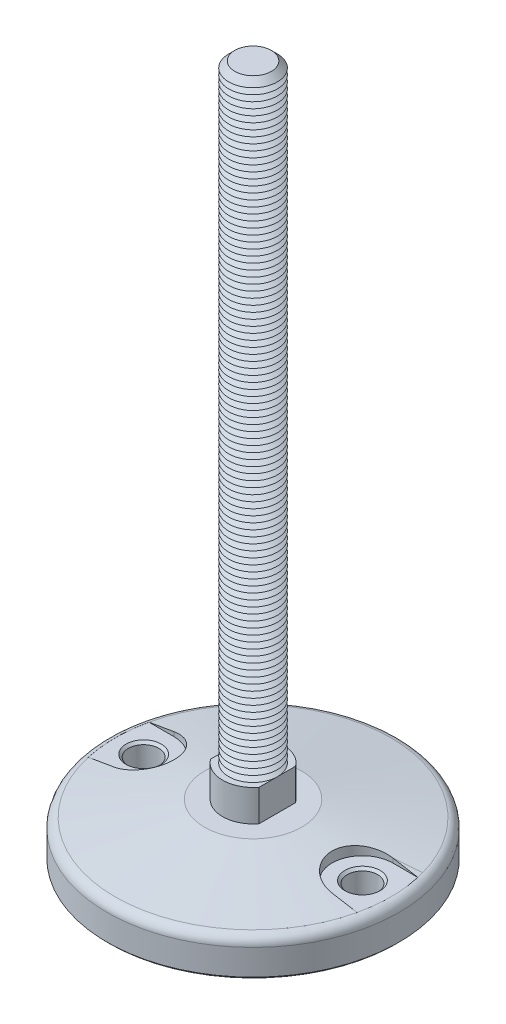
SolidWorks part; units mm, degrees
ref_plane "Front Plane" through (0, 0, 0) normal (0, 0, 1) x (1, 0, 0)
ref_plane "Top Plane" through (0, 0, 0) normal (0, 1, 0) x (1, 0, 0)
ref_plane "Right Plane" through (0, 0, 0) normal (1, 0, 0) x (0, 0, -1)
sketch "Sketch1" plane through (0, 0, 0) normal (1, 0, 0) x (0, 0, -1)
  line L0 (0, 61.3389) -> (0, -58.404) construction
sketch "Sketch2" plane through (0, 0, 0) normal (1, 0, 0) x (0, 0, -1)
  line L0 (0, 0) -> (-20, 0)
  line L1 (-20, 0) -> (-60, -7.0531)
  line L2 (-60, -7.0531) -> (-60, -22)
  line L3 (-60, -22) -> (0, -22)
  line L4 (0, 61.3389) -> (0, -58.404) construction
  line L5 (0, -22) -> (0, 0)
  dimension "D1" = 22
  dimension "D2" = 60
  dimension "D3" = 20
  dimension "D4" = 10
revolve "Revolve1" add sketch "Sketch2" angle 360 about L0
fillet "Fillet1" radius 4 1 edges at (0, -7.0531, 60)
sketch "Sketch3" plane through (0, 0, 0) normal (0, 1, 0) x (1, 0, 0)
  circle A0 centre (0, 0) radius 12.5
  dimension "D1" = 25
extrude "Boss-Extrude1" add sketch "Sketch3" along normal blind 13
sketch "Sketch4" plane through (0, 13, 0) normal (0, 1, 0) x (1, 0, 0)
  line L0 (-10, 7.5) -> (-10, -7.5)
  line L2 (10, -7.5) -> (10, 7.5)
  arc A0 (-10, 7.5) -> (-10, -7.5) centre (0, 0) ccw
  circle A1 centre (0, 0) radius 12.5 construction
  arc A2 (10, -7.5) -> (10, 7.5) centre (0, 0) ccw
  dimension "D1" = 20
extrude "Cut-Extrude1" cut sketch "Sketch4" against normal blind 13
sketch "Sketch5" plane through (0, 13, 0) normal (0, 1, 0) x (1, 0, 0)
  circle A0 centre (0, 0) radius 10
  dimension "D1" = 20
extrude "Boss-Extrude2" add sketch "Sketch5" along normal blind 250
chamfer "Chamfer1" distance 2.5 angle 45 1 edges at (0, 263, 10)
sketch "Sketch6" plane through (0, 0, 0) normal (1, 0, 0) x (0, 0, -1)
  line L0 (-10, 13) -> (-7.8349, 14.25)
  line L1 (-7.8349, 14.25) -> (-10, 15.5)
  line L2 (-10, 260.5) -> (-10, 13) construction
  line L3 (-10, 15.5) -> (-10, 13)
  dimension "D1" = 2.5
revolve "Cut-Revolve1" cut sketch "Sketch6" angle 360 about L0
pattern_linear "LPattern1" count 99 spacing 2.5 along (0, 1, 0) of "Cut-Revolve1"
sketch "Sketch8" plane through (0, 0, 0) normal (0, 1, 0) x (1, 0, 0)
  line L0 (-45, 12.5) -> (-55.2994, 12.5)
  line L1 (-45, -12.5) -> (-55.2994, -12.5)
  arc A1 (-55.2994, 12.5) -> (-55.2994, -12.5) centre (0, 0) ccw
  circle A2 centre (0, 0) radius 56.6946 construction
  arc A3 (-45, -12.5) -> (-45, 12.5) centre (-45, 0) ccw
  point P3 (-45, 0)
  point P11 (0, 0)
  dimension "D1" = 45
  dimension "D2" = 25
extrude "Cut-Extrude4" cut sketch "Sketch8" against normal blind 6.5
sketch "Sketch10" plane through (0, -6.5, 0) normal (0, 1, 0) x (1, 0, 0)
  circle A0 centre (-45, 0) radius 6.25
  dimension "D1" = 12.5
extrude "Cut-Extrude5" cut sketch "Sketch10" against normal up to surface (15.5 mm away)
chamfer "Chamfer2" distance 1 angle 45 2 edges at (-45, -22, -6.25) (-45, -6.5, 6.25)
mirror "Mirror1" about plane through (0, 0, 0) normal (1, 0, 0) of "Chamfer2", "Cut-Extrude5", "Cut-Extrude4"
chamfer "Chamfer3" distance 1 angle 45 1 edges at (0, -22, 60)
